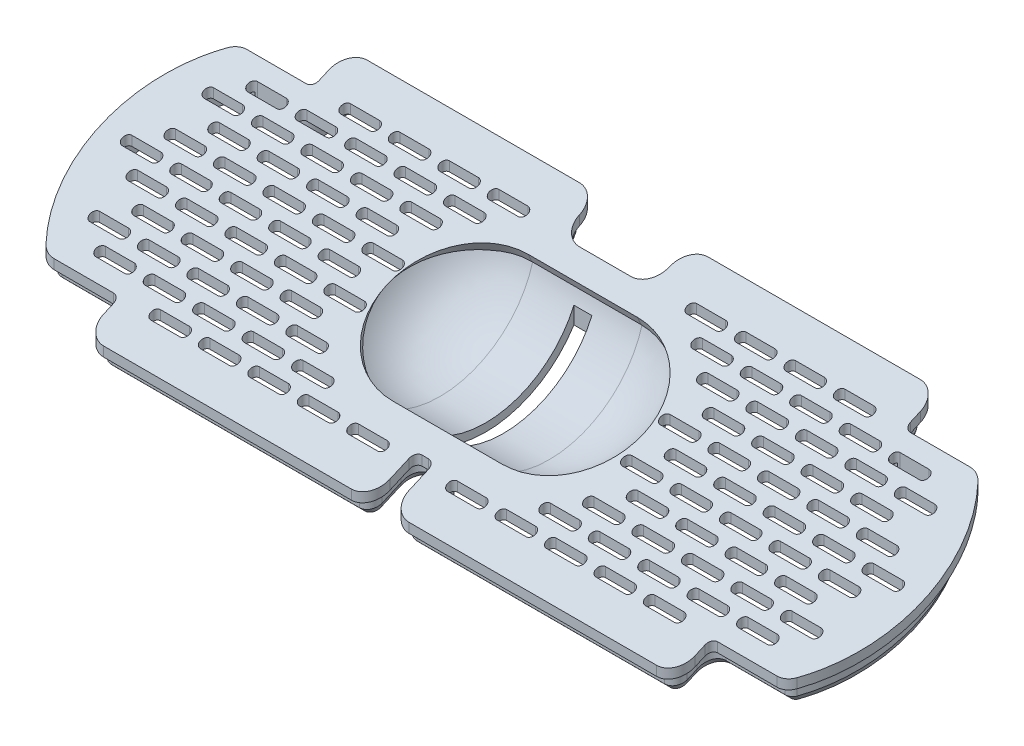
SolidWorks part; units mm, degrees
ref_plane "Ebene vorne" through (0, 0, 0) normal (0, 0, 1) x (1, 0, 0)
ref_plane "Ebene oben" through (0, 0, 0) normal (0, 1, 0) x (1, 0, 0)
ref_plane "Ebene rechts" through (0, 0, 0) normal (1, 0, 0) x (0, 0, -1)
sketch "Skizze2" plane through (0, 0, 0) normal (0, -1, 0) x (1, 0, 0)
  line L0 (46, -16) -> (46, -17.5) construction
  line L1 (56.2377, -15) -> (47, -15) construction
  line L2 (47, 15) -> (56.2377, 15) construction
  line L3 (46, 17.5) -> (46, 16) construction
  line L4 (4.5, 20.5) -> (43, 20.5) construction
  line L5 (1.5, 14.5) -> (1.5, 17.5) construction
  line L6 (-0.5, 13.5) -> (0.5, 13.5) construction
  line L7 (-1.5, 17.5) -> (-1.5, 14.5) construction
  line L8 (-43, 20.5) -> (-4.5, 20.5) construction
  line L9 (-46, 17.5) -> (-46, 16) construction
  line L10 (-47, 15) -> (-56.2377, 15) construction
  line L11 (-56.2377, -15) -> (-47, -15) construction
  line L12 (-46, -16) -> (-46, -17.5) construction
  line L13 (-10, -20.5) -> (-43, -20.5) construction
  line L14 (4, -14.5) -> (-4, -14.5) construction
  line L15 (43, -20.5) -> (10, -20.5) construction
  line L16 (46, -16) -> (46, -17.5)
  line L17 (56.2377, -15) -> (47, -15)
  line L18 (47, 15) -> (56.2377, 15)
  line L19 (46, 17.5) -> (46, 16)
  line L20 (4.5, 20.5) -> (43, 20.5)
  line L21 (1.5, 14.5) -> (1.5, 17.5)
  line L22 (-0.5, 13.5) -> (0.5, 13.5)
  line L23 (-1.5, 17.5) -> (-1.5, 14.5)
  line L24 (-43, 20.5) -> (-4.5, 20.5)
  line L25 (-46, 17.5) -> (-46, 16)
  line L26 (-47, 15) -> (-56.2377, 15)
  line L27 (-56.2377, -15) -> (-47, -15)
  line L28 (-46, -16) -> (-46, -17.5)
  line L29 (-10, -20.5) -> (-43, -20.5)
  line L30 (4, -14.5) -> (-4, -14.5)
  line L31 (43, -20.5) -> (10, -20.5)
  arc A0 (43, -20.5) -> (46, -17.5) centre (43, -17.5) ccw construction
  arc A1 (47, -15) -> (46, -16) centre (47, -16) ccw construction
  arc A2 (56.2377, -15) -> (58.4214, -14.0571) centre (56.2377, -12) ccw construction
  arc A3 (58.4214, -14.0571) -> (58.4214, 14.0571) centre (43.5, 0) ccw construction
  arc A4 (58.4214, 14.0571) -> (56.2377, 15) centre (56.2377, 12) ccw construction
  arc A5 (46, 16) -> (47, 15) centre (47, 16) ccw construction
  arc A6 (46, 17.5) -> (43, 20.5) centre (43, 17.5) ccw construction
  arc A7 (4.5, 20.5) -> (1.5, 17.5) centre (4.5, 17.5) ccw construction
  arc A8 (0.5, 13.5) -> (1.5, 14.5) centre (0.5, 14.5) ccw construction
  arc A9 (-1.5, 14.5) -> (-0.5, 13.5) centre (-0.5, 14.5) ccw construction
  arc A10 (-1.5, 17.5) -> (-4.5, 20.5) centre (-4.5, 17.5) ccw construction
  arc A11 (-43, 20.5) -> (-46, 17.5) centre (-43, 17.5) ccw construction
  arc A12 (-47, 15) -> (-46, 16) centre (-47, 16) ccw construction
  arc A13 (-56.2377, 15) -> (-58.4214, 14.0571) centre (-56.2377, 12) ccw construction
  arc A14 (-58.4214, 14.0571) -> (-58.4214, -14.0571) centre (-43.5, 0) ccw construction
  arc A15 (-58.4214, -14.0571) -> (-56.2377, -15) centre (-56.2377, -12) ccw construction
  arc A16 (-46, -16) -> (-47, -15) centre (-47, -16) ccw construction
  arc A17 (-46, -17.5) -> (-43, -20.5) centre (-43, -17.5) ccw construction
  arc A18 (-10, -20.5) -> (-7, -17.5) centre (-10, -17.5) ccw construction
  arc A19 (-4, -14.5) -> (-7, -17.5) centre (-4, -17.5) ccw construction
  arc A20 (7, -17.5) -> (4, -14.5) centre (4, -17.5) ccw construction
  arc A21 (7, -17.5) -> (10, -20.5) centre (10, -17.5) ccw construction
  arc A22 (43, -20.5) -> (46, -17.5) centre (43, -17.5) ccw
  arc A23 (47, -15) -> (46, -16) centre (47, -16) ccw
  arc A24 (56.2377, -15) -> (58.4214, -14.0571) centre (56.2377, -12) ccw
  arc A25 (58.4214, -14.0571) -> (58.4214, 14.0571) centre (43.5, 0) ccw
  arc A26 (58.4214, 14.0571) -> (56.2377, 15) centre (56.2377, 12) ccw
  arc A27 (46, 16) -> (47, 15) centre (47, 16) ccw
  arc A28 (46, 17.5) -> (43, 20.5) centre (43, 17.5) ccw
  arc A29 (4.5, 20.5) -> (1.5, 17.5) centre (4.5, 17.5) ccw
  arc A30 (0.5, 13.5) -> (1.5, 14.5) centre (0.5, 14.5) ccw
  arc A31 (-1.5, 14.5) -> (-0.5, 13.5) centre (-0.5, 14.5) ccw
  arc A32 (-1.5, 17.5) -> (-4.5, 20.5) centre (-4.5, 17.5) ccw
  arc A33 (-43, 20.5) -> (-46, 17.5) centre (-43, 17.5) ccw
  arc A34 (-47, 15) -> (-46, 16) centre (-47, 16) ccw
  arc A35 (-56.2377, 15) -> (-58.4214, 14.0571) centre (-56.2377, 12) ccw
  arc A36 (-58.4214, 14.0571) -> (-58.4214, -14.0571) centre (-43.5, 0) ccw
  arc A37 (-58.4214, -14.0571) -> (-56.2377, -15) centre (-56.2377, -12) ccw
  arc A38 (-46, -16) -> (-47, -15) centre (-47, -16) ccw
  arc A39 (-46, -17.5) -> (-43, -20.5) centre (-43, -17.5) ccw
  arc A40 (-10, -20.5) -> (-7, -17.5) centre (-10, -17.5) ccw
  arc A41 (-4, -14.5) -> (-7, -17.5) centre (-4, -17.5) ccw
  arc A42 (7, -17.5) -> (4, -14.5) centre (4, -17.5) ccw
  arc A43 (7, -17.5) -> (10, -20.5) centre (10, -17.5) ccw
extrude "Aufsatz-Linear austragen1" add sketch "Skizze2" against normal blind 26
sketch "Skizze3" plane through (0, 0, 0) normal (1, 0, 0) x (0, 0, -1)
  line L0 (-20.5, 8) -> (20.5, 26)
  line L1 (20.5, 26) -> (-20.5, 26)
  line L2 (-20.5, 26) -> (-20.5, 8)
  line L3 (-20.5, 26) -> (-20.5, 0) construction
  line L4 (14.0571, 26) -> (-14.0571, 26) construction
  line L5 (-20.5, 6.5) -> (20.5, 24.5)
  line L6 (20.5, 24.5) -> (20.5, 0)
  line L7 (20.5, 0) -> (-20.5, 0)
  line L8 (-20.5, 0) -> (-20.5, 6.5)
  line L9 (-14.0571, 0) -> (14.0571, 0) construction
  dimension "D1" = 1.5
  dimension "D2" = 1.5
extrude "Schnitt-Linear austragen1" cut sketch "Skizze3" against normal through all both and the other way through all
sketch "Skizze4" plane through (0, 0, 0) normal (0, 1, 0) x (1, 0, 0)
  line L0 (44.75, 16) -> (44.75, 17.5) construction
  line L1 (56.2377, 13.75) -> (47, 13.75) construction
  line L2 (47, -13.75) -> (56.2377, -13.75) construction
  line L3 (44.75, -17.5) -> (44.75, -16) construction
  line L4 (4.5, -19.25) -> (43, -19.25) construction
  line L5 (2.75, -14.5) -> (2.75, -17.5) construction
  line L6 (-1, -12.3063) -> (1, -12.3063) construction
  line L7 (-2.75, -17.5) -> (-2.75, -14.5) construction
  line L8 (-43, -19.25) -> (-4.5, -19.25) construction
  line L9 (-44.75, -17.5) -> (-44.75, -16) construction
  line L10 (-47, -13.75) -> (-56.2377, -13.75) construction
  line L11 (-56.2377, 13.75) -> (-47, 13.75) construction
  line L12 (-44.75, 16) -> (-44.75, 17.5) construction
  line L13 (-10, 19.25) -> (-43, 19.25) construction
  line L14 (4, 13.25) -> (-4, 13.25) construction
  line L15 (43, 19.25) -> (10, 19.25) construction
  line L16 (44.75, 16) -> (44.75, 17.5)
  line L17 (56.2377, 13.75) -> (47, 13.75)
  line L18 (47, -13.75) -> (56.2377, -13.75)
  line L19 (44.75, -17.5) -> (44.75, -16)
  line L20 (4.5, -19.25) -> (43, -19.25)
  line L21 (2.75, -14.5) -> (2.75, -17.5)
  line L22 (-1, -12.3063) -> (1, -12.3063)
  line L23 (-2.75, -17.5) -> (-2.75, -14.5)
  line L24 (-43, -19.25) -> (-4.5, -19.25)
  line L25 (-44.75, -17.5) -> (-44.75, -16)
  line L26 (-47, -13.75) -> (-56.2377, -13.75)
  line L27 (-56.2377, 13.75) -> (-47, 13.75)
  line L28 (-44.75, 16) -> (-44.75, 17.5)
  line L29 (-10, 19.25) -> (-43, 19.25)
  line L30 (4, 13.25) -> (-4, 13.25)
  line L31 (43, 19.25) -> (10, 19.25)
  arc A0 (44.75, 17.5) -> (43, 19.25) centre (43, 17.5) ccw construction
  arc A1 (44.75, 16) -> (47, 13.75) centre (47, 16) ccw construction
  arc A2 (57.5115, 13.2) -> (56.2377, 13.75) centre (56.2377, 12) ccw construction
  arc A3 (57.5115, -13.2) -> (57.5115, 13.2) centre (43.5, 0) ccw construction
  arc A4 (56.2377, -13.75) -> (57.5115, -13.2) centre (56.2377, -12) ccw construction
  arc A5 (47, -13.75) -> (44.75, -16) centre (47, -16) ccw construction
  arc A6 (43, -19.25) -> (44.75, -17.5) centre (43, -17.5) ccw construction
  arc A7 (2.75, -17.5) -> (4.5, -19.25) centre (4.5, -17.5) ccw construction
  arc A8 (2.75, -14.5) -> (1, -12.3063) centre (0.5, -14.5) ccw construction
  arc A9 (-1, -12.3063) -> (-2.75, -14.5) centre (-0.5, -14.5) ccw construction
  arc A10 (-4.5, -19.25) -> (-2.75, -17.5) centre (-4.5, -17.5) ccw construction
  arc A11 (-44.75, -17.5) -> (-43, -19.25) centre (-43, -17.5) ccw construction
  arc A12 (-44.75, -16) -> (-47, -13.75) centre (-47, -16) ccw construction
  arc A13 (-57.5115, -13.2) -> (-56.2377, -13.75) centre (-56.2377, -12) ccw construction
  arc A14 (-57.5115, 13.2) -> (-57.5115, -13.2) centre (-43.5, 0) ccw construction
  arc A15 (-56.2377, 13.75) -> (-57.5115, 13.2) centre (-56.2377, 12) ccw construction
  arc A16 (-47, 13.75) -> (-44.75, 16) centre (-47, 16) ccw construction
  arc A17 (-43, 19.25) -> (-44.75, 17.5) centre (-43, 17.5) ccw construction
  arc A18 (-8.25, 17.5) -> (-10, 19.25) centre (-10, 17.5) ccw construction
  arc A19 (-8.25, 17.5) -> (-4, 13.25) centre (-4, 17.5) ccw construction
  arc A20 (4, 13.25) -> (8.25, 17.5) centre (4, 17.5) ccw construction
  arc A21 (10, 19.25) -> (8.25, 17.5) centre (10, 17.5) ccw construction
  arc A22 (44.75, 17.5) -> (43, 19.25) centre (43, 17.5) ccw
  arc A23 (44.75, 16) -> (47, 13.75) centre (47, 16) ccw
  arc A24 (57.5115, 13.2) -> (56.2377, 13.75) centre (56.2377, 12) ccw
  arc A25 (57.5115, -13.2) -> (57.5115, 13.2) centre (43.5, 0) ccw
  arc A26 (56.2377, -13.75) -> (57.5115, -13.2) centre (56.2377, -12) ccw
  arc A27 (47, -13.75) -> (44.75, -16) centre (47, -16) ccw
  arc A28 (43, -19.25) -> (44.75, -17.5) centre (43, -17.5) ccw
  arc A29 (2.75, -17.5) -> (4.5, -19.25) centre (4.5, -17.5) ccw
  arc A30 (2.75, -14.5) -> (1, -12.3063) centre (0.5, -14.5) ccw
  arc A31 (-1, -12.3063) -> (-2.75, -14.5) centre (-0.5, -14.5) ccw
  arc A32 (-4.5, -19.25) -> (-2.75, -17.5) centre (-4.5, -17.5) ccw
  arc A33 (-44.75, -17.5) -> (-43, -19.25) centre (-43, -17.5) ccw
  arc A34 (-44.75, -16) -> (-47, -13.75) centre (-47, -16) ccw
  arc A35 (-57.5115, -13.2) -> (-56.2377, -13.75) centre (-56.2377, -12) ccw
  arc A36 (-57.5115, 13.2) -> (-57.5115, -13.2) centre (-43.5, 0) ccw
  arc A37 (-56.2377, 13.75) -> (-57.5115, 13.2) centre (-56.2377, 12) ccw
  arc A38 (-47, 13.75) -> (-44.75, 16) centre (-47, 16) ccw
  arc A39 (-43, 19.25) -> (-44.75, 17.5) centre (-43, 17.5) ccw
  arc A40 (-8.25, 17.5) -> (-10, 19.25) centre (-10, 17.5) ccw
  arc A41 (-8.25, 17.5) -> (-4, 13.25) centre (-4, 17.5) ccw
  arc A42 (4, 13.25) -> (8.25, 17.5) centre (4, 17.5) ccw
  arc A43 (10, 19.25) -> (8.25, 17.5) centre (10, 17.5) ccw
extrude "Aufsatz-Linear austragen2" add sketch "Skizze4" along normal up to surface (24.0244 mm away) separate body
sketch "Skizze5" plane through (0, 0, 0) normal (1, 0, 0) x (0, 0, -1)
  line L0 (-20.5, 3) -> (20.5, 21)
  line L1 (20.5, 21) -> (20.5, 0)
  line L2 (20.5, 0) -> (-20.5, 0)
  line L3 (-20.5, 0) -> (-20.5, 3)
  line L4 (-20.5, 8) -> (-20.5, 6.5) construction
  line L5 (13.2, 22.7951) -> (-13.2, 11.2049) construction
  line L6 (20.5, 26) -> (20.5, 24.5) construction
  dimension "D1" = 3.5
extrude "Schnitt-Linear austragen2" cut sketch "Skizze5" against normal through all both and the other way through all
shell "Wandung1" thickness 1.25
sketch "Skizze7" plane through (0, 14.2529, 6.2574) normal (0, 0.9156, 0.402) x (1, 0, 0)
  line L0 (-8.5, 7.3799) -> (8.5, 7.3799) construction
  line L1 (-8.5, 18.8799) -> (8.5, 18.8799)
  line L2 (-8.5, -4.1201) -> (8.5, -4.1201)
  line L3 (4, 22.6697) -> (-4, 22.6697) construction
  line L4 (-0.5, -7.9099) -> (0.5, -7.9099) construction
  line L5 (0, 7.3799) -> (0, 0) construction
  arc A0 (-8.5, 18.8799) -> (-8.5, -4.1201) centre (-8.5, 7.3799) ccw
  arc A1 (8.5, -4.1201) -> (8.5, 18.8799) centre (8.5, 7.3799) ccw
  point P2 (0, 7.3799)
  point P14 (20, 7.3799)
  point P15 (-20, 7.3799)
  dimension "D2" = 40
  dimension "D1" = 23
extrude "Schnitt-Linear austragen3" cut sketch "Skizze7" against normal blind 10
ref_plane "Ebene1" through (0, 2.9666, -6.7574) normal (0, -0.402, 0.9156) x (1, 0, 0)
sketch "Skizze12" plane through (0, 2.9666, -6.7574) normal (0, -0.402, 0.9156) x (1, 0, 0)
  line L0 (-10.6656, 23.5659) -> (14.2337, 23.5659) construction
  line L1 (8.5, 8.5659) -> (-8.5, 8.5659)
  line L2 (-20, 15.5659) -> (-20, 13.1884)
  line L3 (-8.5, 14.3159) -> (-8.5, 15.5659) construction
  line L4 (8.5, 15.5659) -> (-8.5, 15.5659) construction
  line L5 (8.5, 14.3159) -> (8.5, 15.5659) construction
  line L12 (8.5, 7.3159) -> (-8.5, 7.3159)
  line L15 (20, 15.5659) -> (20, 13.1884)
  arc A4 (8.5, 8.5659) -> (20, 15.5659) centre (8.5, 21.5124) ccw
  arc A5 (8.5, 7.3159) -> (20, 13.1884) centre (8.5, 21.5124) ccw
  arc A6 (-8.5, 8.5659) -> (-20, 15.5659) centre (-8.5, 21.5124) cw
  arc A7 (-8.5, 7.3159) -> (-20, 13.1884) centre (-8.5, 21.5124) cw
  dimension "D1" = 30
  dimension "D3" = 1.25
  dimension "D2" = 8
revolve "Rotation1" add sketch "Skizze12" angle 114 mid plane about L0
sketch "Skizze15" plane through (0, 14.2529, 6.2574) normal (0, 0.9156, 0.402) x (1, 0, 0)
  line L0 (-9.35, 7.3799) -> (9.35, 7.3799) construction
  line L1 (-30.3482, 22.554) -> (30.3482, 22.554)
  line L2 (-30.3482, 22.554) -> (-30.3482, -7.7942)
  line L3 (-30.3482, -7.7942) -> (30.3482, -7.7942)
  line L4 (30.3482, 22.554) -> (30.3482, -7.7942)
  line L5 (-30.3482, 22.554) -> (30.3482, -7.7942) construction
  line L6 (-30.3482, -7.7942) -> (30.3482, 22.554) construction
  point P0 (0, 7.3799)
extrude "Schnitt-Linear austragen4" cut sketch "Skizze15" along normal blind 10
sketch "Skizze17" plane through (0, 0, 0) normal (0, 1, 0) x (1, 0, 0)
  line L1 (-1.4, -10.0299) -> (1.4, -10.0299)
  line L2 (-1.4, -10.0299) -> (-1.4, 11.0299)
  line L3 (-1.4, 11.0299) -> (1.4, 11.0299)
  line L4 (1.4, -10.0299) -> (1.4, 11.0299)
  line L5 (-1.4, -10.0299) -> (1.4, 11.0299) construction
  line L6 (-1.4, 11.0299) -> (1.4, -10.0299) construction
  line L7 (8.5, 11.0299) -> (-8.5, 11.0299) construction
  line L8 (-8.5, -10.0299) -> (8.5, -10.0299) construction
  line L9 (0, 11.0299) -> (0, 0) construction
  point P0 (0, 0.5)
  dimension "D1" = 2.8
extrude "Schnitt-Linear austragen5" cut sketch "Skizze17" along normal through all
sketch "Skizze19" plane through (0, 0, 0) normal (0, 1, 0) x (1, 0, 0)
  line L0 (60, 0) -> (55.5, 0) construction
  line L1 (60, -0.75) -> (55.5, -0.75)
  line L2 (60, 0) -> (0, 0) construction
  line L3 (60, 0.75) -> (55.5, 0.75)
  arc A3 (60, -0.75) -> (60, 0.75) centre (60, 0) ccw
  arc A4 (55.5, 0.75) -> (55.5, -0.75) centre (55.5, 0) ccw
  point P2 (57.75, 0)
  dimension "D1" = 60
  dimension "D2" = 1.5
  dimension "D3" = 4.5
extrude "Schnitt-Linear austragen6" cut sketch "Skizze19" along normal through all
other "Füllmuster1" parameters "D5"=0, "D6"=0, "D1"=5.02, "D2"=40, "D3"=0, "D9"=104, "D7"=24, "D8"=14
fillet "Fase1" radius 0.5 38 edges at (0, 6.5973, 12.3063) (-2.2589, 6.2502, 13.0969) (-2.75, 4.9756, 16) (-3.2626, 3.7738, 18.7374) (-23.75, 3.5488, 19.25) (-44.2374, 3.7738, 18.7374) (-44.75, 4.6463, 16.75) (2.2589, 6.2502, 13.0969) (-45.409, 5.6741, 14.409) (2.75, 4.9756, 16) (-51.6189, 5.9634, 13.75) (3.2626, 3.7738, 18.7374) (-56.9315, 6.0264, 13.6066) (23.75, 3.5488, 19.25) (-62.75, 12, 0) (44.2374, 3.7738, 18.7374) (-56.9315, 17.9736, -13.6066) (44.75, 4.6463, 16.75) (-51.6189, 18.0366, -13.75) (45.409, 5.6741, 14.409) (-45.409, 18.3259, -14.409) (51.6189, 5.9634, 13.75) (-44.75, 19.3537, -16.75) (56.9315, 6.0264, 13.6066) (-44.2374, 20.2262, -18.7374) (62.75, 12, 0) (-26.5, 20.4512, -19.25) (56.9315, 17.9736, -13.6066) (-8.7626, 20.2262, -18.7374) (51.6189, 18.0366, -13.75) (-7.0052, 18.3636, -14.4948) (45.409, 18.3259, -14.409) (0, 17.8171, -13.25) (44.75, 19.3537, -16.75) (7.0052, 18.3636, -14.4948) (44.2374, 20.2262, -18.7374) (8.7626, 20.2262, -18.7374) (26.5, 20.4512, -19.25)
